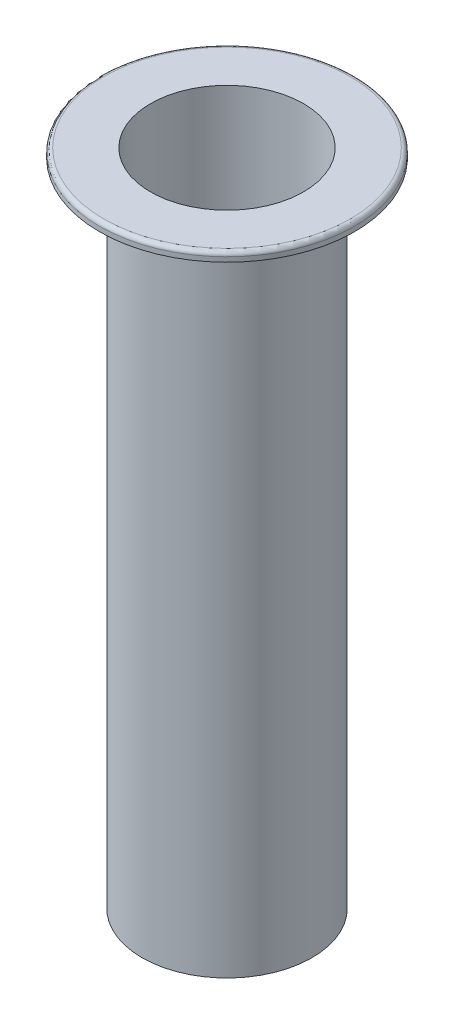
SolidWorks part; units mm, degrees
ref_plane "Alzado" through (0, 0, 0) normal (0, 0, 1) x (1, 0, 0)
ref_plane "Planta" through (0, 0, 0) normal (0, 1, 0) x (1, 0, 0)
ref_plane "Vista lateral" through (0, 0, 0) normal (1, 0, 0) x (0, 0, -1)
sketch "Croquis1" plane through (0, 0, 0) normal (0, 1, 0) x (1, 0, 0)
  circle A0 centre (0, 0) radius 20
  dimension "D1" = 40
extrude "Saliente-Extruir1" add sketch "Croquis1" against normal blind 150
sketch "Croquis2" plane through (0, 0, 0) normal (0, 1, 0) x (1, 0, 0)
  circle A0 centre (0, 0) radius 30
  dimension "D1" = 60
extrude "Saliente-Extruir2" add sketch "Croquis2" along normal blind 5
sketch "Croquis3" plane through (0, -150, 0) normal (0, -1, 0) x (1, 0, 0)
  circle A2 centre (0, 0) radius 18
  circle A3 centre (0, 0) radius 18
  dimension "D1" = 2
extrude "Cortar-Extruir1" cut sketch "Croquis3" against normal through all
chamfer "Chaflán1" distance 5 angle 30 1 edges at (0, 0, 30)
fillet "Redondeo1" radius 1 1 edges at (0, 5, 30)
